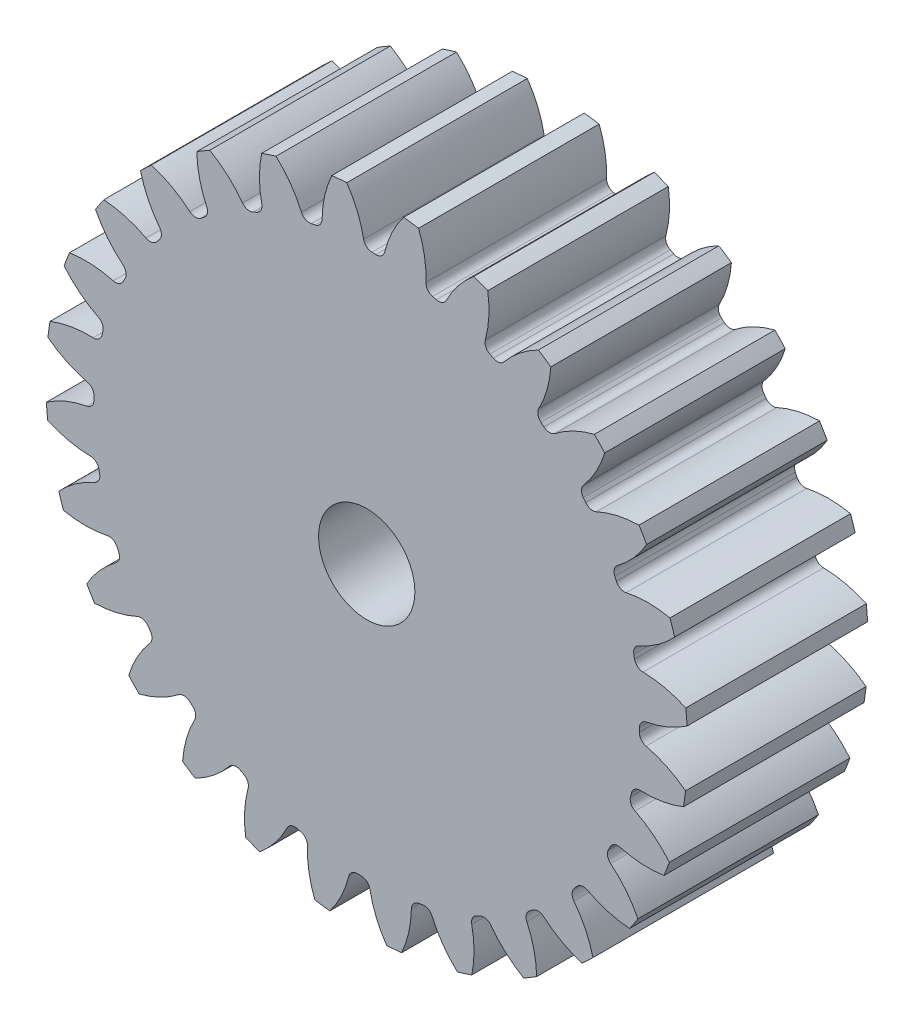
SolidWorks part; units mm, degrees
ref_plane "Front" through (0, 0, 0) normal (0, 0, 1) x (1, 0, 0)
ref_plane "Top" through (0, 0, 0) normal (0, 1, 0) x (1, 0, 0)
ref_plane "Right" through (0, 0, 0) normal (1, 0, 0) x (0, 0, -1)
sketch "Sketch3" plane through (0, 0, 0) normal (0, 0, 1) x (1, 0, 0)
  circle A0 centre (0, 0) radius 169.3333
  dimension "od" = 338.6667
extrude "gearBody" add sketch "Sketch3" along normal blind 95.25
sketch "Sketch2" plane through (0, 0, 0) normal (0, 0, 1) x (1, 0, 0)
  line L0 (0, 0) -> (137.2083, 56.8335) construction
  line L1 (168.5237, -19.7267) -> (0, 0) construction
  line L2 (0, 0) -> (36.3143, 0) construction
  line L3 (157.9763, 4.6398) -> (157.5072, -13.0199) construction
  line L5 (157.7418, -4.1901) -> (0, 0) construction
  line L7 (0, 0) -> (148.5132, 0) construction
  arc A0 (148.5022, 1.8068) -> (148.1969, -9.6879) centre (0, 0) ccw construction
  arc A1 (169.0059, 10.5257) -> (168.2088, -19.4831) centre (0, 0) ccw construction
  arc A2 (157.9763, 4.6398) -> (157.5072, -13.0199) centre (0, 0) ccw construction
  arc A3 (143.8514, -4.8561) -> (143.9063, -2.7876) centre (0, 0) ccw
  arc A4 (168.5237, -19.7267) -> (147.3511, -9.474) centre (133.9976, -64.0376) ccw
  arc A5 (168.5237, -19.7267) -> (169.3333, 10.7523) centre (0, 0) ccw
  arc A6 (169.3333, 10.7523) -> (147.6463, 1.638) centre (137.2083, 56.8335) cw
  arc A7 (143.9063, -2.7876) -> (147.6463, 1.638) centre (148.5001, -2.8766) cw
  arc A8 (147.3511, -9.474) -> (143.8514, -4.8561) centre (148.4434, -5.0111) cw
  point P6 (169.3333, 10.7523)
  point P22 (168.5237, -19.7267)
  dimension "baseDia" = 297.0264
  dimension "od" = 338.6667
  dimension "pd" = 316.0889
  dimension "rd" = 287.8667
  dimension "rFillet" = 4.5946
  dimension "pointX" = 169.3333
  dimension "pointY" = 10.7523
  dimension "CTT" = 17.6597
  dimension "flankCenterAngle" = 22.5
extrude "toothCut" cut sketch "Sketch2" along normal through all
pattern_circular "CirPattern1" count 28 over 360 about axis through (0, 0, 0) along (0, 0, 1) of "toothCut"
sketch "hub1Dia" plane through (0, 0, 0) normal (0, 0, -1) x (-1, 0, 0)
  circle A0 centre (0, 0) radius 12.7
  dimension "hub1Dia" = 25.4
sketch "hub2Dia" plane through (0, 0, 95.25) normal (0, 0, 1) x (1, 0, 0)
  circle A0 centre (0, 0) radius 12.7
  dimension "hub2dia" = 25.4
sketch "boreDia" plane through (0, 0, 0) normal (0, 0, 1) x (1, 0, 0)
  circle A0 centre (0, 0) radius 25.4
  dimension "boreDia" = 50.8
extrude "bore" cut sketch "boreDia" against normal mid plane 25400
